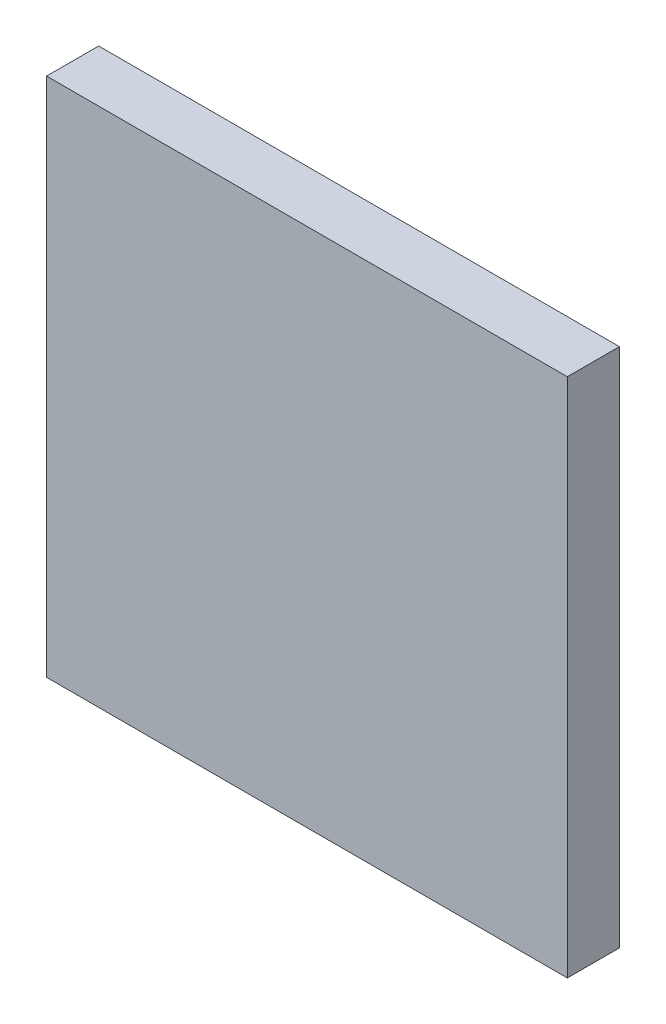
SolidWorks part; units mm, degrees
ref_plane "Front Plane" through (0, 0, 0) normal (0, 0, 1) x (1, 0, 0)
ref_plane "Top Plane" through (0, 0, 0) normal (0, 1, 0) x (1, 0, 0)
ref_plane "Right Plane" through (0, 0, 0) normal (1, 0, 0) x (0, 0, -1)
sketch "Sketch1" plane through (0, 0, 0) normal (0, 0, 1) x (1, 0, 0)
  line L1 (77.3592, -219.871) -> (-49.6408, -219.871)
  line L2 (77.3592, -219.871) -> (77.3592, -92.871)
  line L3 (77.3592, -92.871) -> (-49.6408, -92.871)
  line L4 (-49.6408, -219.871) -> (-49.6408, -92.871)
  line L5 (77.3592, -219.871) -> (-49.6408, -92.871) construction
  line L6 (77.3592, -92.871) -> (-49.6408, -219.871) construction
  point P4 (13.8592, -156.371)
  dimension "D1" = 127
  dimension "D2" = 127
extrude "Boss-Extrude1" add sketch "Sketch1" along normal blind 12.7
